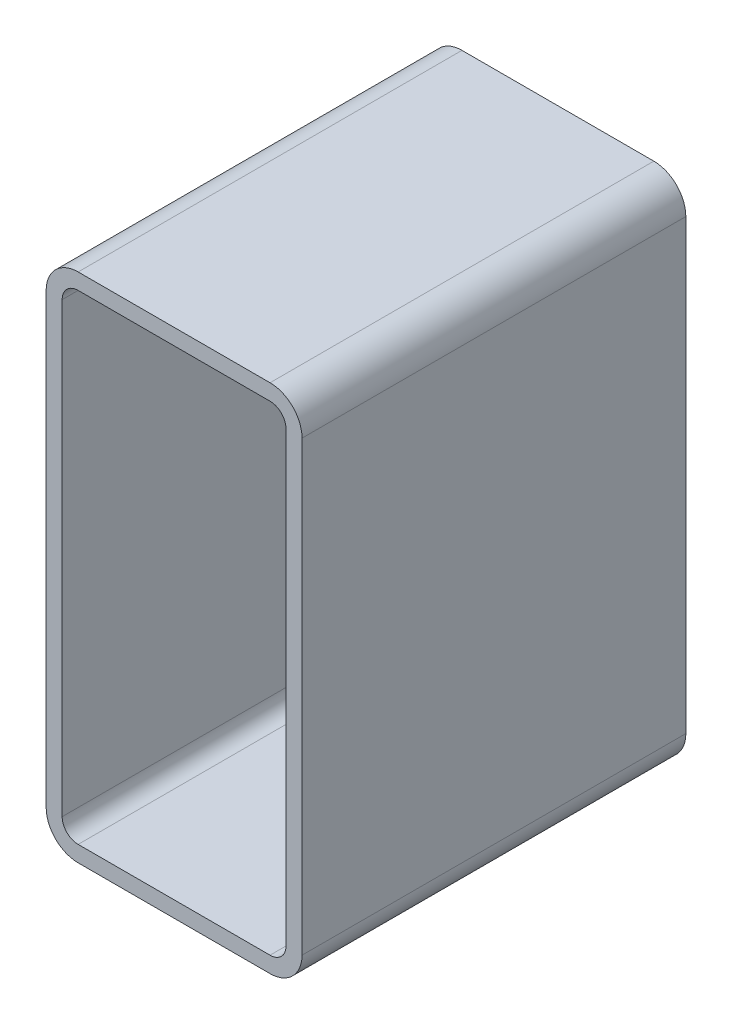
SolidWorks part; units mm, degrees
ref_plane "Front Plane" through (0, 0, 0) normal (0, 0, 1) x (1, 0, 0)
ref_plane "Top Plane" through (0, 0, 0) normal (0, 1, 0) x (1, 0, 0)
ref_plane "Right Plane" through (0, 0, 0) normal (1, 0, 0) x (0, 0, -1)
sketch "Sketch1" plane through (0, 0, 0) normal (0, 0, 1) x (1, 0, 0)
sketch_block_instance "HSS16x8x0.500-1"
sketch_block "HSS16x8x0.500"
extrude "Boss-Extrude1" add sketch "Sketch1" along normal blind 304.8
